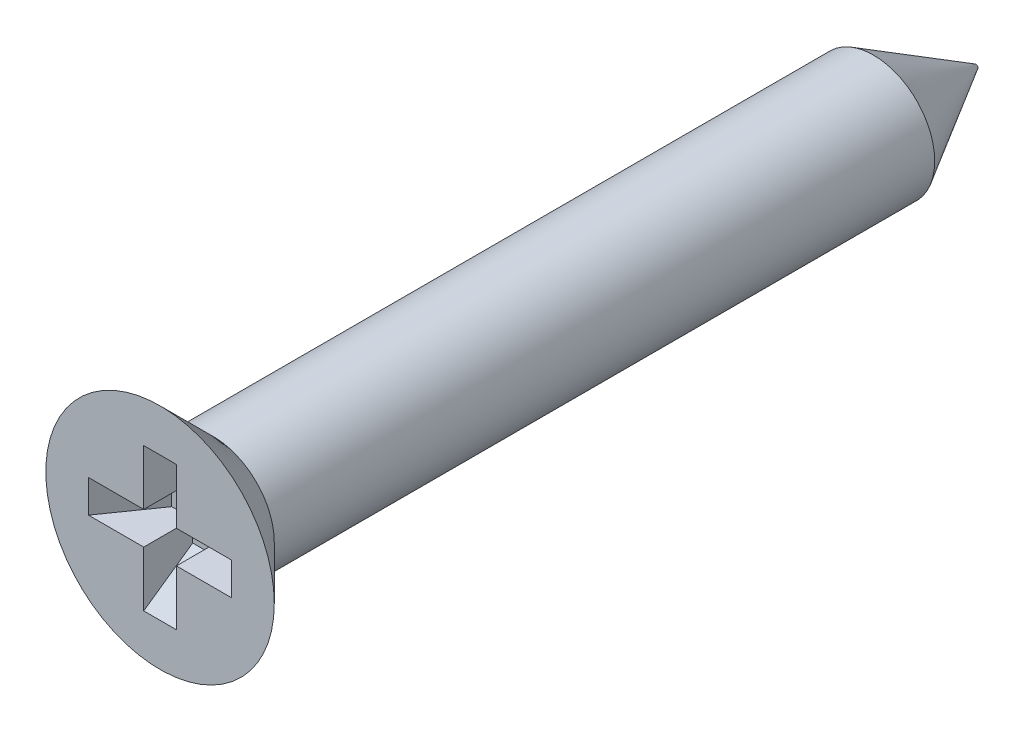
SolidWorks part; units mm, degrees
ref_plane "Plan de face" through (0, 0, 0) normal (0, 0, 1) x (1, 0, 0)
ref_plane "Plan de dessus" through (0, 0, 0) normal (0, 1, 0) x (1, 0, 0)
ref_plane "Plan de droite" through (0, 0, 0) normal (1, 0, 0) x (0, 0, -1)
sketch "Esquisse1" plane through (0, 0, 0) normal (1, 0, 0) x (0, 0, -1)
  line L0 (-1.6035, 0) -> (7.1529, 0) construction
  line L1 (0, 5.0438) -> (0, -4.594) construction
  line L2 (0, 2.8) -> (1.3, 1.5)
  line L3 (1.3, 1.5) -> (1.3, 0)
  line L4 (-1.442, 2.8) -> (2.7621, 2.8) construction
  line L5 (0, 2.8) -> (8.0274, -5.2274) construction
  line L6 (-1.0988, 1.5) -> (4.1029, 1.5) construction
  line L7 (1.3, 0) -> (0, 0)
  line L9 (0, 2.8) -> (0, 0)
revolve "Révolution2" add sketch "Esquisse1" angle 360 about L0
sketch "Esquisse3" plane through (0, 0, 0) normal (0, 0, 1) x (1, 0, 0)
  circle A0 centre (0, 0) radius 1.5
extrude "Extrusion1" add sketch "Esquisse3" against normal blind 20
sketch "Esquisse2" plane through (0, 0, 0) normal (0, 0, 1) x (1, 0, 0)
  line L0 (0.4, -0.4) -> (1.755, -0.4)
  line L1 (0.4, 0.4) -> (1.755, 0.4)
  line L2 (-1.755, -0.4) -> (-0.4, -0.4)
  line L3 (-0.4, 1.755) -> (-0.4, 0.4)
  line L4 (-1.755, 0.4) -> (-0.4, 0.4)
  line L5 (0.4, 1.755) -> (0.4, 0.4)
  line L6 (-0.4, 1.755) -> (0.4, 1.755)
  line L7 (1.755, 0.4) -> (1.755, -0.4)
  line L8 (0.4, -1.755) -> (-0.4, -1.755)
  line L9 (-1.755, -0.4) -> (-1.755, 0.4)
  line L10 (-0.4, -0.4) -> (-0.4, -1.755)
  line L12 (0.4, -0.4) -> (0.4, -1.755)
  circle A0 centre (0, 0) radius 1.8 construction
extrude "Enlèv. mat.-Extru.2" cut sketch "Esquisse2" against normal blind 1.2
draft "Dépouille3" type of draft neutral plane draft angle 35 faces to draft 4 parameters "D1"=35
chamfer "Chanfrein1" distance 1.45 angle 60 1 edges at (1.5, 0, -20)
